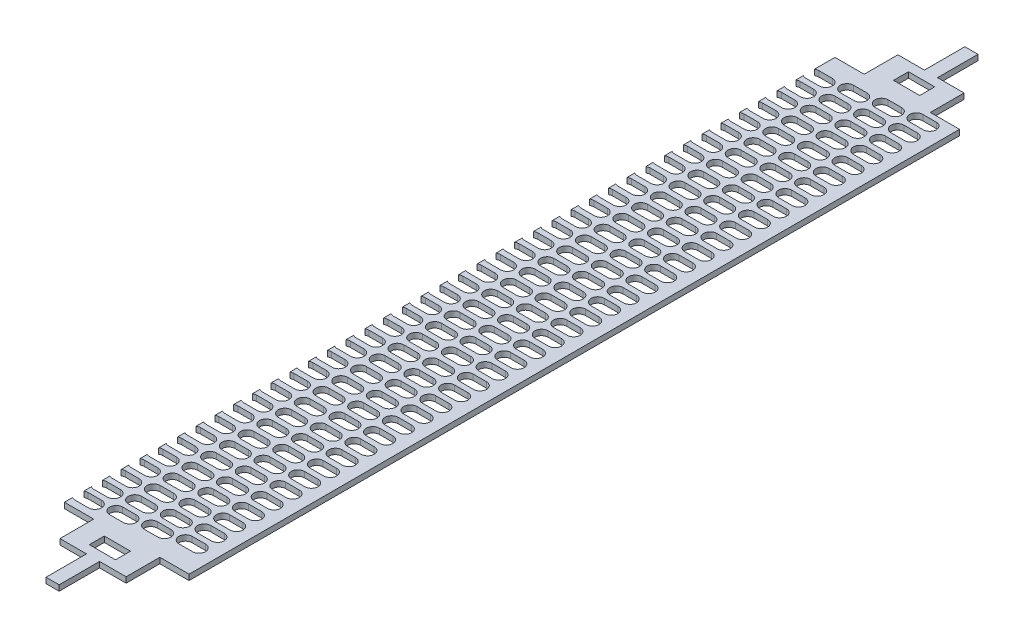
SolidWorks part; units mm, degrees
ref_plane "Alzado" through (0, 0, 0) normal (0, 0, 1) x (1, 0, 0)
ref_plane "Planta" through (0, 0, 0) normal (0, 1, 0) x (1, 0, 0)
ref_plane "Vista lateral" through (0, 0, 0) normal (1, 0, 0) x (0, 0, -1)
sketch "Croquis1" plane through (0, 0, 0) normal (0, 1, 0) x (1, 0, 0)
  line L0 (15.6, 411.2) -> (15.6, 429.2)
  line L1 (0, 0) -> (15.6, 0)
  line L2 (0, 0) -> (0, 4.2983)
  line L3 (0, 411.2) -> (15.6, 411.2)
  line L4 (66.5, 0) -> (66.5, 411.2)
  line L5 (15.6, 429.2) -> (29.75, 429.2)
  line L6 (29.75, 429.2) -> (29.75, 450.8)
  line L7 (29.75, 450.8) -> (36.75, 450.8)
  line L8 (36.75, 450.8) -> (36.75, 429.2)
  line L9 (36.75, 429.2) -> (50.9, 429.2)
  line L10 (50.9, 429.2) -> (50.9, 411.2)
  line L11 (50.9, 411.2) -> (66.5, 411.2)
  line L12 (15.6, 420.2) -> (50.9, 420.2) construction
  line L13 (50.9, 0) -> (50.9, -18)
  line L14 (26.25, 416.2) -> (40.25, 416.2)
  line L15 (26.25, 416.2) -> (26.25, 424.2)
  line L16 (26.25, 424.2) -> (40.25, 424.2)
  line L17 (40.25, 416.2) -> (40.25, 424.2)
  line L18 (26.25, 416.2) -> (40.25, 424.2) construction
  line L19 (26.25, 424.2) -> (40.25, 416.2) construction
  line L20 (50.9, -18) -> (36.75, -18)
  line L21 (36.75, -18) -> (36.75, -39.6)
  line L22 (36.75, -39.6) -> (29.75, -39.6)
  line L23 (29.75, -39.6) -> (29.75, -18)
  line L24 (29.75, -18) -> (15.6, -18)
  line L25 (15.6, -18) -> (15.6, 0)
  line L26 (50.9, 0) -> (66.5, 0)
  line L27 (15.6, -9) -> (50.9, -9) construction
  line L28 (49.8, 408.3) -> (57, 408.3)
  line L29 (26.25, -13) -> (40.25, -13)
  line L30 (26.25, -13) -> (26.25, -5)
  line L31 (26.25, -5) -> (40.25, -5)
  line L32 (40.25, -13) -> (40.25, -5)
  line L33 (26.25, -13) -> (40.25, -5) construction
  line L34 (26.25, -5) -> (40.25, -13) construction
  line L35 (49.8, 401.3) -> (57, 401.3)
  line L36 (33.8, 398.8) -> (41, 398.8)
  line L37 (33.8, 405.8) -> (41, 405.8)
  line L38 (17.8, 396.3) -> (25, 396.3)
  line L39 (17.8, 403.3) -> (25, 403.3)
  line L40 (1.8, 393.8) -> (9, 393.8)
  line L41 (1.8, 400.8) -> (9, 400.8)
  line L42 (0, 400.3017) -> (0, 411.2)
  line L43 (49.8, 398.3) -> (57, 398.3)
  line L44 (49.8, 391.3) -> (57, 391.3)
  line L45 (33.8, 395.8) -> (41, 395.8)
  line L46 (33.8, 388.8) -> (41, 388.8)
  line L47 (17.8, 393.3) -> (25, 393.3)
  line L48 (17.8, 386.3) -> (25, 386.3)
  line L49 (1.8, 390.8) -> (9, 390.8)
  line L50 (1.8, 383.8) -> (9, 383.8)
  line L51 (49.8, 388.3) -> (57, 388.3)
  line L52 (49.8, 381.3) -> (57, 381.3)
  line L53 (33.8, 385.8) -> (41, 385.8)
  line L54 (33.8, 378.8) -> (41, 378.8)
  line L55 (17.8, 383.3) -> (25, 383.3)
  line L56 (17.8, 376.3) -> (25, 376.3)
  line L57 (1.8, 380.8) -> (9, 380.8)
  line L58 (1.8, 373.8) -> (9, 373.8)
  line L59 (49.8, 378.3) -> (57, 378.3)
  line L60 (49.8, 371.3) -> (57, 371.3)
  line L61 (33.8, 375.8) -> (41, 375.8)
  line L62 (33.8, 368.8) -> (41, 368.8)
  line L63 (17.8, 373.3) -> (25, 373.3)
  line L64 (17.8, 366.3) -> (25, 366.3)
  line L65 (1.8, 370.8) -> (9, 370.8)
  line L66 (1.8, 363.8) -> (9, 363.8)
  line L67 (49.8, 368.3) -> (57, 368.3)
  line L68 (49.8, 361.3) -> (57, 361.3)
  line L69 (33.8, 365.8) -> (41, 365.8)
  line L70 (33.8, 358.8) -> (41, 358.8)
  line L71 (17.8, 363.3) -> (25, 363.3)
  line L72 (17.8, 356.3) -> (25, 356.3)
  line L73 (1.8, 360.8) -> (9, 360.8)
  line L74 (1.8, 353.8) -> (9, 353.8)
  line L75 (49.8, 358.3) -> (57, 358.3)
  line L76 (49.8, 351.3) -> (57, 351.3)
  line L77 (33.8, 355.8) -> (41, 355.8)
  line L78 (33.8, 348.8) -> (41, 348.8)
  line L79 (17.8, 353.3) -> (25, 353.3)
  line L80 (17.8, 346.3) -> (25, 346.3)
  line L81 (1.8, 350.8) -> (9, 350.8)
  line L82 (1.8, 343.8) -> (9, 343.8)
  line L83 (49.8, 348.3) -> (57, 348.3)
  line L84 (49.8, 341.3) -> (57, 341.3)
  line L85 (33.8, 345.8) -> (41, 345.8)
  line L86 (33.8, 338.8) -> (41, 338.8)
  line L87 (17.8, 343.3) -> (25, 343.3)
  line L88 (17.8, 336.3) -> (25, 336.3)
  line L89 (1.8, 340.8) -> (9, 340.8)
  line L90 (1.8, 333.8) -> (9, 333.8)
  line L91 (49.8, 338.3) -> (57, 338.3)
  line L92 (49.8, 331.3) -> (57, 331.3)
  line L93 (33.8, 335.8) -> (41, 335.8)
  line L94 (33.8, 328.8) -> (41, 328.8)
  line L95 (17.8, 333.3) -> (25, 333.3)
  line L96 (17.8, 326.3) -> (25, 326.3)
  line L97 (1.8, 330.8) -> (9, 330.8)
  line L98 (1.8, 323.8) -> (9, 323.8)
  line L99 (49.8, 328.3) -> (57, 328.3)
  line L100 (49.8, 321.3) -> (57, 321.3)
  line L101 (33.8, 325.8) -> (41, 325.8)
  line L102 (33.8, 318.8) -> (41, 318.8)
  line L103 (17.8, 323.3) -> (25, 323.3)
  line L104 (17.8, 316.3) -> (25, 316.3)
  line L105 (1.8, 320.8) -> (9, 320.8)
  line L106 (1.8, 313.8) -> (9, 313.8)
  line L107 (49.8, 318.3) -> (57, 318.3)
  line L108 (49.8, 311.3) -> (57, 311.3)
  line L109 (33.8, 315.8) -> (41, 315.8)
  line L110 (33.8, 308.8) -> (41, 308.8)
  line L111 (17.8, 313.3) -> (25, 313.3)
  line L112 (17.8, 306.3) -> (25, 306.3)
  line L113 (1.8, 310.8) -> (9, 310.8)
  line L114 (1.8, 303.8) -> (9, 303.8)
  line L115 (49.8, 308.3) -> (57, 308.3)
  line L116 (49.8, 301.3) -> (57, 301.3)
  line L117 (33.8, 305.8) -> (41, 305.8)
  line L118 (33.8, 298.8) -> (41, 298.8)
  line L119 (17.8, 303.3) -> (25, 303.3)
  line L120 (17.8, 296.3) -> (25, 296.3)
  line L121 (1.8, 300.8) -> (9, 300.8)
  line L122 (1.8, 293.8) -> (9, 293.8)
  line L123 (49.8, 298.3) -> (57, 298.3)
  line L124 (49.8, 291.3) -> (57, 291.3)
  line L125 (33.8, 295.8) -> (41, 295.8)
  line L126 (33.8, 288.8) -> (41, 288.8)
  line L127 (17.8, 293.3) -> (25, 293.3)
  line L128 (17.8, 286.3) -> (25, 286.3)
  line L129 (1.8, 290.8) -> (9, 290.8)
  line L130 (1.8, 283.8) -> (9, 283.8)
  line L131 (49.8, 288.3) -> (57, 288.3)
  line L132 (49.8, 281.3) -> (57, 281.3)
  line L133 (33.8, 285.8) -> (41, 285.8)
  line L134 (33.8, 278.8) -> (41, 278.8)
  line L135 (17.8, 283.3) -> (25, 283.3)
  line L136 (17.8, 276.3) -> (25, 276.3)
  line L137 (1.8, 280.8) -> (9, 280.8)
  line L138 (1.8, 273.8) -> (9, 273.8)
  line L139 (49.8, 278.3) -> (57, 278.3)
  line L140 (49.8, 271.3) -> (57, 271.3)
  line L141 (33.8, 275.8) -> (41, 275.8)
  line L142 (33.8, 268.8) -> (41, 268.8)
  line L143 (17.8, 273.3) -> (25, 273.3)
  line L144 (17.8, 266.3) -> (25, 266.3)
  line L145 (1.8, 270.8) -> (9, 270.8)
  line L146 (1.8, 263.8) -> (9, 263.8)
  line L147 (49.8, 268.3) -> (57, 268.3)
  line L148 (49.8, 261.3) -> (57, 261.3)
  line L149 (33.8, 265.8) -> (41, 265.8)
  line L150 (33.8, 258.8) -> (41, 258.8)
  line L151 (17.8, 263.3) -> (25, 263.3)
  line L152 (17.8, 256.3) -> (25, 256.3)
  line L153 (1.8, 260.8) -> (9, 260.8)
  line L154 (1.8, 253.8) -> (9, 253.8)
  line L155 (49.8, 258.3) -> (57, 258.3)
  line L156 (49.8, 251.3) -> (57, 251.3)
  line L157 (33.8, 255.8) -> (41, 255.8)
  line L158 (33.8, 248.8) -> (41, 248.8)
  line L159 (17.8, 253.3) -> (25, 253.3)
  line L160 (17.8, 246.3) -> (25, 246.3)
  line L161 (1.8, 250.8) -> (9, 250.8)
  line L162 (1.8, 243.8) -> (9, 243.8)
  line L163 (49.8, 248.3) -> (57, 248.3)
  line L164 (49.8, 241.3) -> (57, 241.3)
  line L165 (33.8, 245.8) -> (41, 245.8)
  line L166 (33.8, 238.8) -> (41, 238.8)
  line L167 (17.8, 243.3) -> (25, 243.3)
  line L168 (17.8, 236.3) -> (25, 236.3)
  line L169 (1.8, 240.8) -> (9, 240.8)
  line L170 (1.8, 233.8) -> (9, 233.8)
  line L171 (49.8, 238.3) -> (57, 238.3)
  line L172 (49.8, 231.3) -> (57, 231.3)
  line L173 (33.8, 235.8) -> (41, 235.8)
  line L174 (33.8, 228.8) -> (41, 228.8)
  line L175 (17.8, 233.3) -> (25, 233.3)
  line L176 (17.8, 226.3) -> (25, 226.3)
  line L177 (1.8, 230.8) -> (9, 230.8)
  line L178 (1.8, 223.8) -> (9, 223.8)
  line L179 (49.8, 228.3) -> (57, 228.3)
  line L180 (49.8, 221.3) -> (57, 221.3)
  line L181 (33.8, 225.8) -> (41, 225.8)
  line L182 (33.8, 218.8) -> (41, 218.8)
  line L183 (17.8, 223.3) -> (25, 223.3)
  line L184 (17.8, 216.3) -> (25, 216.3)
  line L185 (1.8, 220.8) -> (9, 220.8)
  line L186 (1.8, 213.8) -> (9, 213.8)
  line L187 (49.8, 218.3) -> (57, 218.3)
  line L188 (49.8, 211.3) -> (57, 211.3)
  line L189 (33.8, 215.8) -> (41, 215.8)
  line L190 (33.8, 208.8) -> (41, 208.8)
  line L191 (17.8, 213.3) -> (25, 213.3)
  line L192 (17.8, 206.3) -> (25, 206.3)
  line L193 (1.8, 210.8) -> (9, 210.8)
  line L194 (1.8, 203.8) -> (9, 203.8)
  line L195 (49.8, 208.3) -> (57, 208.3)
  line L196 (49.8, 201.3) -> (57, 201.3)
  line L197 (33.8, 205.8) -> (41, 205.8)
  line L198 (33.8, 198.8) -> (41, 198.8)
  line L199 (17.8, 203.3) -> (25, 203.3)
  line L200 (17.8, 196.3) -> (25, 196.3)
  line L201 (1.8, 200.8) -> (9, 200.8)
  line L202 (1.8, 193.8) -> (9, 193.8)
  line L203 (49.8, 198.3) -> (57, 198.3)
  line L204 (49.8, 191.3) -> (57, 191.3)
  line L205 (33.8, 195.8) -> (41, 195.8)
  line L206 (33.8, 188.8) -> (41, 188.8)
  line L207 (17.8, 193.3) -> (25, 193.3)
  line L208 (17.8, 186.3) -> (25, 186.3)
  line L209 (1.8, 190.8) -> (9, 190.8)
  line L210 (1.8, 183.8) -> (9, 183.8)
  line L211 (49.8, 188.3) -> (57, 188.3)
  line L212 (49.8, 181.3) -> (57, 181.3)
  line L213 (33.8, 185.8) -> (41, 185.8)
  line L214 (33.8, 178.8) -> (41, 178.8)
  line L215 (17.8, 183.3) -> (25, 183.3)
  line L216 (17.8, 176.3) -> (25, 176.3)
  line L217 (1.8, 180.8) -> (9, 180.8)
  line L218 (1.8, 173.8) -> (9, 173.8)
  line L219 (49.8, 178.3) -> (57, 178.3)
  line L220 (49.8, 171.3) -> (57, 171.3)
  line L221 (33.8, 175.8) -> (41, 175.8)
  line L222 (33.8, 168.8) -> (41, 168.8)
  line L223 (17.8, 173.3) -> (25, 173.3)
  line L224 (17.8, 166.3) -> (25, 166.3)
  line L225 (1.8, 170.8) -> (9, 170.8)
  line L226 (1.8, 163.8) -> (9, 163.8)
  line L227 (49.8, 168.3) -> (57, 168.3)
  line L228 (49.8, 161.3) -> (57, 161.3)
  line L229 (33.8, 165.8) -> (41, 165.8)
  line L230 (33.8, 158.8) -> (41, 158.8)
  line L231 (17.8, 163.3) -> (25, 163.3)
  line L232 (17.8, 156.3) -> (25, 156.3)
  line L233 (1.8, 160.8) -> (9, 160.8)
  line L234 (1.8, 153.8) -> (9, 153.8)
  line L235 (49.8, 158.3) -> (57, 158.3)
  line L236 (49.8, 151.3) -> (57, 151.3)
  line L237 (33.8, 155.8) -> (41, 155.8)
  line L238 (33.8, 148.8) -> (41, 148.8)
  line L239 (17.8, 153.3) -> (25, 153.3)
  line L240 (17.8, 146.3) -> (25, 146.3)
  line L241 (1.8, 150.8) -> (9, 150.8)
  line L242 (1.8, 143.8) -> (9, 143.8)
  line L243 (49.8, 148.3) -> (57, 148.3)
  line L244 (49.8, 141.3) -> (57, 141.3)
  line L245 (33.8, 145.8) -> (41, 145.8)
  line L246 (33.8, 138.8) -> (41, 138.8)
  line L247 (17.8, 143.3) -> (25, 143.3)
  line L248 (17.8, 136.3) -> (25, 136.3)
  line L249 (1.8, 140.8) -> (9, 140.8)
  line L250 (1.8, 133.8) -> (9, 133.8)
  line L251 (49.8, 138.3) -> (57, 138.3)
  line L252 (49.8, 131.3) -> (57, 131.3)
  line L253 (33.8, 135.8) -> (41, 135.8)
  line L254 (33.8, 128.8) -> (41, 128.8)
  line L255 (17.8, 133.3) -> (25, 133.3)
  line L256 (17.8, 126.3) -> (25, 126.3)
  line L257 (1.8, 130.8) -> (9, 130.8)
  line L258 (1.8, 123.8) -> (9, 123.8)
  line L259 (49.8, 128.3) -> (57, 128.3)
  line L260 (49.8, 121.3) -> (57, 121.3)
  line L261 (33.8, 125.8) -> (41, 125.8)
  line L262 (33.8, 118.8) -> (41, 118.8)
  line L263 (17.8, 123.3) -> (25, 123.3)
  line L264 (17.8, 116.3) -> (25, 116.3)
  line L265 (1.8, 120.8) -> (9, 120.8)
  line L266 (1.8, 113.8) -> (9, 113.8)
  line L267 (49.8, 118.3) -> (57, 118.3)
  line L268 (49.8, 111.3) -> (57, 111.3)
  line L269 (33.8, 115.8) -> (41, 115.8)
  line L270 (33.8, 108.8) -> (41, 108.8)
  line L271 (17.8, 113.3) -> (25, 113.3)
  line L272 (17.8, 106.3) -> (25, 106.3)
  line L273 (1.8, 110.8) -> (9, 110.8)
  line L274 (1.8, 103.8) -> (9, 103.8)
  line L275 (49.8, 108.3) -> (57, 108.3)
  line L276 (49.8, 101.3) -> (57, 101.3)
  line L277 (33.8, 105.8) -> (41, 105.8)
  line L278 (33.8, 98.8) -> (41, 98.8)
  line L279 (17.8, 103.3) -> (25, 103.3)
  line L280 (17.8, 96.3) -> (25, 96.3)
  line L281 (1.8, 100.8) -> (9, 100.8)
  line L282 (1.8, 93.8) -> (9, 93.8)
  line L283 (49.8, 98.3) -> (57, 98.3)
  line L284 (49.8, 91.3) -> (57, 91.3)
  line L285 (33.8, 95.8) -> (41, 95.8)
  line L286 (33.8, 88.8) -> (41, 88.8)
  line L287 (17.8, 93.3) -> (25, 93.3)
  line L288 (17.8, 86.3) -> (25, 86.3)
  line L289 (1.8, 90.8) -> (9, 90.8)
  line L290 (1.8, 83.8) -> (9, 83.8)
  line L291 (49.8, 88.3) -> (57, 88.3)
  line L292 (49.8, 81.3) -> (57, 81.3)
  line L293 (33.8, 85.8) -> (41, 85.8)
  line L294 (33.8, 78.8) -> (41, 78.8)
  line L295 (17.8, 83.3) -> (25, 83.3)
  line L296 (17.8, 76.3) -> (25, 76.3)
  line L297 (1.8, 80.8) -> (9, 80.8)
  line L298 (1.8, 73.8) -> (9, 73.8)
  line L299 (49.8, 78.3) -> (57, 78.3)
  line L300 (49.8, 71.3) -> (57, 71.3)
  line L301 (33.8, 75.8) -> (41, 75.8)
  line L302 (33.8, 68.8) -> (41, 68.8)
  line L303 (17.8, 73.3) -> (25, 73.3)
  line L304 (17.8, 66.3) -> (25, 66.3)
  line L305 (1.8, 70.8) -> (9, 70.8)
  line L306 (1.8, 63.8) -> (9, 63.8)
  line L307 (49.8, 68.3) -> (57, 68.3)
  line L308 (49.8, 61.3) -> (57, 61.3)
  line L309 (33.8, 65.8) -> (41, 65.8)
  line L310 (33.8, 58.8) -> (41, 58.8)
  line L311 (17.8, 63.3) -> (25, 63.3)
  line L312 (17.8, 56.3) -> (25, 56.3)
  line L313 (1.8, 60.8) -> (9, 60.8)
  line L314 (1.8, 53.8) -> (9, 53.8)
  line L315 (49.8, 58.3) -> (57, 58.3)
  line L316 (49.8, 51.3) -> (57, 51.3)
  line L317 (33.8, 55.8) -> (41, 55.8)
  line L318 (33.8, 48.8) -> (41, 48.8)
  line L319 (17.8, 53.3) -> (25, 53.3)
  line L320 (17.8, 46.3) -> (25, 46.3)
  line L321 (1.8, 50.8) -> (9, 50.8)
  line L322 (1.8, 43.8) -> (9, 43.8)
  line L323 (49.8, 48.3) -> (57, 48.3)
  line L324 (49.8, 41.3) -> (57, 41.3)
  line L325 (33.8, 45.8) -> (41, 45.8)
  line L326 (33.8, 38.8) -> (41, 38.8)
  line L327 (17.8, 43.3) -> (25, 43.3)
  line L328 (17.8, 36.3) -> (25, 36.3)
  line L329 (1.8, 40.8) -> (9, 40.8)
  line L330 (1.8, 33.8) -> (9, 33.8)
  line L331 (49.8, 38.3) -> (57, 38.3)
  line L332 (49.8, 31.3) -> (57, 31.3)
  line L333 (33.8, 35.8) -> (41, 35.8)
  line L334 (33.8, 28.8) -> (41, 28.8)
  line L335 (17.8, 33.3) -> (25, 33.3)
  line L336 (17.8, 26.3) -> (25, 26.3)
  line L337 (1.8, 30.8) -> (9, 30.8)
  line L338 (1.8, 23.8) -> (9, 23.8)
  line L339 (49.8, 28.3) -> (57, 28.3)
  line L340 (49.8, 21.3) -> (57, 21.3)
  line L341 (33.8, 25.8) -> (41, 25.8)
  line L342 (33.8, 18.8) -> (41, 18.8)
  line L343 (17.8, 23.3) -> (25, 23.3)
  line L344 (17.8, 16.3) -> (25, 16.3)
  line L345 (1.8, 20.8) -> (9, 20.8)
  line L346 (1.8, 13.8) -> (9, 13.8)
  line L347 (49.8, 18.3) -> (57, 18.3)
  line L348 (49.8, 11.3) -> (57, 11.3)
  line L349 (33.8, 15.8) -> (41, 15.8)
  line L350 (33.8, 8.8) -> (41, 8.8)
  line L351 (17.8, 13.3) -> (25, 13.3)
  line L352 (17.8, 6.3) -> (25, 6.3)
  line L353 (1.8, 10.8) -> (9, 10.8)
  line L354 (1.8, 3.8) -> (9, 3.8)
  line L355 (0, 10.3017) -> (0, 14.2983)
  line L356 (0, 20.3017) -> (0, 24.2983)
  line L357 (0, 30.3017) -> (0, 34.2983)
  line L358 (0, 40.3017) -> (0, 44.2983)
  line L359 (0, 50.3017) -> (0, 54.2983)
  line L360 (0, 60.3017) -> (0, 64.2983)
  line L361 (0, 70.3017) -> (0, 74.2983)
  line L362 (0, 80.3017) -> (0, 84.2983)
  line L363 (0, 90.3017) -> (0, 94.2983)
  line L364 (0, 100.3017) -> (0, 104.2983)
  line L365 (0, 110.3017) -> (0, 114.2983)
  line L366 (0, 120.3017) -> (0, 124.2983)
  line L367 (0, 130.3017) -> (0, 134.2983)
  line L368 (0, 140.3017) -> (0, 144.2983)
  line L369 (0, 150.3017) -> (0, 154.2983)
  line L370 (0, 160.3017) -> (0, 164.2983)
  line L371 (0, 170.3017) -> (0, 174.2983)
  line L372 (0, 180.3017) -> (0, 184.2983)
  line L373 (0, 190.3017) -> (0, 194.2983)
  line L374 (0, 200.3017) -> (0, 204.2983)
  line L375 (0, 210.3017) -> (0, 214.2983)
  line L376 (0, 220.3017) -> (0, 224.2983)
  line L377 (0, 230.3017) -> (0, 234.2983)
  line L378 (0, 240.3017) -> (0, 244.2983)
  line L379 (0, 250.3017) -> (0, 254.2983)
  line L380 (0, 260.3017) -> (0, 264.2983)
  line L381 (0, 270.3017) -> (0, 274.2983)
  line L382 (0, 280.3017) -> (0, 284.2983)
  line L383 (0, 290.3017) -> (0, 294.2983)
  line L384 (0, 300.3017) -> (0, 304.2983)
  line L385 (0, 310.3017) -> (0, 314.2983)
  line L386 (0, 320.3017) -> (0, 324.2983)
  line L387 (0, 330.3017) -> (0, 334.2983)
  line L388 (0, 340.3017) -> (0, 344.2983)
  line L389 (0, 350.3017) -> (0, 354.2983)
  line L390 (0, 360.3017) -> (0, 364.2983)
  line L391 (0, 370.3017) -> (0, 374.2983)
  line L392 (0, 380.3017) -> (0, 384.2983)
  line L393 (0, 390.3017) -> (0, 394.2983)
  arc A0 (57, 401.3) -> (57, 408.3) centre (57, 404.8) ccw
  arc A1 (49.8, 408.3) -> (49.8, 401.3) centre (49.8, 404.8) ccw
  arc A2 (41, 398.8) -> (41, 405.8) centre (41, 402.3) ccw
  arc A3 (33.8, 405.8) -> (33.8, 398.8) centre (33.8, 402.3) ccw
  arc A4 (25, 396.3) -> (25, 403.3) centre (25, 399.8) ccw
  arc A5 (17.8, 403.3) -> (17.8, 396.3) centre (17.8, 399.8) ccw
  arc A6 (9, 393.8) -> (9, 400.8) centre (9, 397.3) ccw
  arc A7 (1.8, 400.8) -> (0, 400.3017) centre (1.8, 397.3) ccw
  arc A8 (0, 394.2983) -> (1.8, 393.8) centre (1.8, 397.3) ccw
  arc A9 (57, 391.3) -> (57, 398.3) centre (57, 394.8) ccw
  arc A10 (49.8, 398.3) -> (49.8, 391.3) centre (49.8, 394.8) ccw
  arc A11 (41, 388.8) -> (41, 395.8) centre (41, 392.3) ccw
  arc A12 (33.8, 395.8) -> (33.8, 388.8) centre (33.8, 392.3) ccw
  arc A13 (25, 386.3) -> (25, 393.3) centre (25, 389.8) ccw
  arc A14 (17.8, 393.3) -> (17.8, 386.3) centre (17.8, 389.8) ccw
  arc A15 (9, 383.8) -> (9, 390.8) centre (9, 387.3) ccw
  arc A16 (1.8, 390.8) -> (0, 390.3017) centre (1.8, 387.3) ccw
  arc A17 (0, 384.2983) -> (1.8, 383.8) centre (1.8, 387.3) ccw
  arc A18 (57, 381.3) -> (57, 388.3) centre (57, 384.8) ccw
  arc A19 (49.8, 388.3) -> (49.8, 381.3) centre (49.8, 384.8) ccw
  arc A20 (41, 378.8) -> (41, 385.8) centre (41, 382.3) ccw
  arc A21 (33.8, 385.8) -> (33.8, 378.8) centre (33.8, 382.3) ccw
  arc A22 (25, 376.3) -> (25, 383.3) centre (25, 379.8) ccw
  arc A23 (17.8, 383.3) -> (17.8, 376.3) centre (17.8, 379.8) ccw
  arc A24 (9, 373.8) -> (9, 380.8) centre (9, 377.3) ccw
  arc A25 (1.8, 380.8) -> (0, 380.3017) centre (1.8, 377.3) ccw
  arc A26 (0, 374.2983) -> (1.8, 373.8) centre (1.8, 377.3) ccw
  arc A27 (57, 371.3) -> (57, 378.3) centre (57, 374.8) ccw
  arc A28 (49.8, 378.3) -> (49.8, 371.3) centre (49.8, 374.8) ccw
  arc A29 (41, 368.8) -> (41, 375.8) centre (41, 372.3) ccw
  arc A30 (33.8, 375.8) -> (33.8, 368.8) centre (33.8, 372.3) ccw
  arc A31 (25, 366.3) -> (25, 373.3) centre (25, 369.8) ccw
  arc A32 (17.8, 373.3) -> (17.8, 366.3) centre (17.8, 369.8) ccw
  arc A33 (9, 363.8) -> (9, 370.8) centre (9, 367.3) ccw
  arc A34 (1.8, 370.8) -> (0, 370.3017) centre (1.8, 367.3) ccw
  arc A35 (0, 364.2983) -> (1.8, 363.8) centre (1.8, 367.3) ccw
  arc A36 (57, 361.3) -> (57, 368.3) centre (57, 364.8) ccw
  arc A37 (49.8, 368.3) -> (49.8, 361.3) centre (49.8, 364.8) ccw
  arc A38 (41, 358.8) -> (41, 365.8) centre (41, 362.3) ccw
  arc A39 (33.8, 365.8) -> (33.8, 358.8) centre (33.8, 362.3) ccw
  arc A40 (25, 356.3) -> (25, 363.3) centre (25, 359.8) ccw
  arc A41 (17.8, 363.3) -> (17.8, 356.3) centre (17.8, 359.8) ccw
  arc A42 (9, 353.8) -> (9, 360.8) centre (9, 357.3) ccw
  arc A43 (1.8, 360.8) -> (0, 360.3017) centre (1.8, 357.3) ccw
  arc A44 (0, 354.2983) -> (1.8, 353.8) centre (1.8, 357.3) ccw
  arc A45 (57, 351.3) -> (57, 358.3) centre (57, 354.8) ccw
  arc A46 (49.8, 358.3) -> (49.8, 351.3) centre (49.8, 354.8) ccw
  arc A47 (41, 348.8) -> (41, 355.8) centre (41, 352.3) ccw
  arc A48 (33.8, 355.8) -> (33.8, 348.8) centre (33.8, 352.3) ccw
  arc A49 (25, 346.3) -> (25, 353.3) centre (25, 349.8) ccw
  arc A50 (17.8, 353.3) -> (17.8, 346.3) centre (17.8, 349.8) ccw
  arc A51 (9, 343.8) -> (9, 350.8) centre (9, 347.3) ccw
  arc A52 (1.8, 350.8) -> (0, 350.3017) centre (1.8, 347.3) ccw
  arc A53 (0, 344.2983) -> (1.8, 343.8) centre (1.8, 347.3) ccw
  arc A54 (57, 341.3) -> (57, 348.3) centre (57, 344.8) ccw
  arc A55 (49.8, 348.3) -> (49.8, 341.3) centre (49.8, 344.8) ccw
  arc A56 (41, 338.8) -> (41, 345.8) centre (41, 342.3) ccw
  arc A57 (33.8, 345.8) -> (33.8, 338.8) centre (33.8, 342.3) ccw
  arc A58 (25, 336.3) -> (25, 343.3) centre (25, 339.8) ccw
  arc A59 (17.8, 343.3) -> (17.8, 336.3) centre (17.8, 339.8) ccw
  arc A60 (9, 333.8) -> (9, 340.8) centre (9, 337.3) ccw
  arc A61 (1.8, 340.8) -> (0, 340.3017) centre (1.8, 337.3) ccw
  arc A62 (0, 334.2983) -> (1.8, 333.8) centre (1.8, 337.3) ccw
  arc A63 (57, 331.3) -> (57, 338.3) centre (57, 334.8) ccw
  arc A64 (49.8, 338.3) -> (49.8, 331.3) centre (49.8, 334.8) ccw
  arc A65 (41, 328.8) -> (41, 335.8) centre (41, 332.3) ccw
  arc A66 (33.8, 335.8) -> (33.8, 328.8) centre (33.8, 332.3) ccw
  arc A67 (25, 326.3) -> (25, 333.3) centre (25, 329.8) ccw
  arc A68 (17.8, 333.3) -> (17.8, 326.3) centre (17.8, 329.8) ccw
  arc A69 (9, 323.8) -> (9, 330.8) centre (9, 327.3) ccw
  arc A70 (1.8, 330.8) -> (0, 330.3017) centre (1.8, 327.3) ccw
  arc A71 (0, 324.2983) -> (1.8, 323.8) centre (1.8, 327.3) ccw
  arc A72 (57, 321.3) -> (57, 328.3) centre (57, 324.8) ccw
  arc A73 (49.8, 328.3) -> (49.8, 321.3) centre (49.8, 324.8) ccw
  arc A74 (41, 318.8) -> (41, 325.8) centre (41, 322.3) ccw
  arc A75 (33.8, 325.8) -> (33.8, 318.8) centre (33.8, 322.3) ccw
  arc A76 (25, 316.3) -> (25, 323.3) centre (25, 319.8) ccw
  arc A77 (17.8, 323.3) -> (17.8, 316.3) centre (17.8, 319.8) ccw
  arc A78 (9, 313.8) -> (9, 320.8) centre (9, 317.3) ccw
  arc A79 (1.8, 320.8) -> (0, 320.3017) centre (1.8, 317.3) ccw
  arc A80 (0, 314.2983) -> (1.8, 313.8) centre (1.8, 317.3) ccw
  arc A81 (57, 311.3) -> (57, 318.3) centre (57, 314.8) ccw
  arc A82 (49.8, 318.3) -> (49.8, 311.3) centre (49.8, 314.8) ccw
  arc A83 (41, 308.8) -> (41, 315.8) centre (41, 312.3) ccw
  arc A84 (33.8, 315.8) -> (33.8, 308.8) centre (33.8, 312.3) ccw
  arc A85 (25, 306.3) -> (25, 313.3) centre (25, 309.8) ccw
  arc A86 (17.8, 313.3) -> (17.8, 306.3) centre (17.8, 309.8) ccw
  arc A87 (9, 303.8) -> (9, 310.8) centre (9, 307.3) ccw
  arc A88 (1.8, 310.8) -> (0, 310.3017) centre (1.8, 307.3) ccw
  arc A89 (0, 304.2983) -> (1.8, 303.8) centre (1.8, 307.3) ccw
  arc A90 (57, 301.3) -> (57, 308.3) centre (57, 304.8) ccw
  arc A91 (49.8, 308.3) -> (49.8, 301.3) centre (49.8, 304.8) ccw
  arc A92 (41, 298.8) -> (41, 305.8) centre (41, 302.3) ccw
  arc A93 (33.8, 305.8) -> (33.8, 298.8) centre (33.8, 302.3) ccw
  arc A94 (25, 296.3) -> (25, 303.3) centre (25, 299.8) ccw
  arc A95 (17.8, 303.3) -> (17.8, 296.3) centre (17.8, 299.8) ccw
  arc A96 (9, 293.8) -> (9, 300.8) centre (9, 297.3) ccw
  arc A97 (1.8, 300.8) -> (0, 300.3017) centre (1.8, 297.3) ccw
  arc A98 (0, 294.2983) -> (1.8, 293.8) centre (1.8, 297.3) ccw
  arc A99 (57, 291.3) -> (57, 298.3) centre (57, 294.8) ccw
  arc A100 (49.8, 298.3) -> (49.8, 291.3) centre (49.8, 294.8) ccw
  arc A101 (41, 288.8) -> (41, 295.8) centre (41, 292.3) ccw
  arc A102 (33.8, 295.8) -> (33.8, 288.8) centre (33.8, 292.3) ccw
  arc A103 (25, 286.3) -> (25, 293.3) centre (25, 289.8) ccw
  arc A104 (17.8, 293.3) -> (17.8, 286.3) centre (17.8, 289.8) ccw
  arc A105 (9, 283.8) -> (9, 290.8) centre (9, 287.3) ccw
  arc A106 (1.8, 290.8) -> (0, 290.3017) centre (1.8, 287.3) ccw
  arc A107 (0, 284.2983) -> (1.8, 283.8) centre (1.8, 287.3) ccw
  arc A108 (57, 281.3) -> (57, 288.3) centre (57, 284.8) ccw
  arc A109 (49.8, 288.3) -> (49.8, 281.3) centre (49.8, 284.8) ccw
  arc A110 (41, 278.8) -> (41, 285.8) centre (41, 282.3) ccw
  arc A111 (33.8, 285.8) -> (33.8, 278.8) centre (33.8, 282.3) ccw
  arc A112 (25, 276.3) -> (25, 283.3) centre (25, 279.8) ccw
  arc A113 (17.8, 283.3) -> (17.8, 276.3) centre (17.8, 279.8) ccw
  arc A114 (9, 273.8) -> (9, 280.8) centre (9, 277.3) ccw
  arc A115 (1.8, 280.8) -> (0, 280.3017) centre (1.8, 277.3) ccw
  arc A116 (0, 274.2983) -> (1.8, 273.8) centre (1.8, 277.3) ccw
  arc A117 (57, 271.3) -> (57, 278.3) centre (57, 274.8) ccw
  arc A118 (49.8, 278.3) -> (49.8, 271.3) centre (49.8, 274.8) ccw
  arc A119 (41, 268.8) -> (41, 275.8) centre (41, 272.3) ccw
  arc A120 (33.8, 275.8) -> (33.8, 268.8) centre (33.8, 272.3) ccw
  arc A121 (25, 266.3) -> (25, 273.3) centre (25, 269.8) ccw
  arc A122 (17.8, 273.3) -> (17.8, 266.3) centre (17.8, 269.8) ccw
  arc A123 (9, 263.8) -> (9, 270.8) centre (9, 267.3) ccw
  arc A124 (1.8, 270.8) -> (0, 270.3017) centre (1.8, 267.3) ccw
  arc A125 (0, 264.2983) -> (1.8, 263.8) centre (1.8, 267.3) ccw
  arc A126 (57, 261.3) -> (57, 268.3) centre (57, 264.8) ccw
  arc A127 (49.8, 268.3) -> (49.8, 261.3) centre (49.8, 264.8) ccw
  arc A128 (41, 258.8) -> (41, 265.8) centre (41, 262.3) ccw
  arc A129 (33.8, 265.8) -> (33.8, 258.8) centre (33.8, 262.3) ccw
  arc A130 (25, 256.3) -> (25, 263.3) centre (25, 259.8) ccw
  arc A131 (17.8, 263.3) -> (17.8, 256.3) centre (17.8, 259.8) ccw
  arc A132 (9, 253.8) -> (9, 260.8) centre (9, 257.3) ccw
  arc A133 (1.8, 260.8) -> (0, 260.3017) centre (1.8, 257.3) ccw
  arc A134 (0, 254.2983) -> (1.8, 253.8) centre (1.8, 257.3) ccw
  arc A135 (57, 251.3) -> (57, 258.3) centre (57, 254.8) ccw
  arc A136 (49.8, 258.3) -> (49.8, 251.3) centre (49.8, 254.8) ccw
  arc A137 (41, 248.8) -> (41, 255.8) centre (41, 252.3) ccw
  arc A138 (33.8, 255.8) -> (33.8, 248.8) centre (33.8, 252.3) ccw
  arc A139 (25, 246.3) -> (25, 253.3) centre (25, 249.8) ccw
  arc A140 (17.8, 253.3) -> (17.8, 246.3) centre (17.8, 249.8) ccw
  arc A141 (9, 243.8) -> (9, 250.8) centre (9, 247.3) ccw
  arc A142 (1.8, 250.8) -> (0, 250.3017) centre (1.8, 247.3) ccw
  arc A143 (0, 244.2983) -> (1.8, 243.8) centre (1.8, 247.3) ccw
  arc A144 (57, 241.3) -> (57, 248.3) centre (57, 244.8) ccw
  arc A145 (49.8, 248.3) -> (49.8, 241.3) centre (49.8, 244.8) ccw
  arc A146 (41, 238.8) -> (41, 245.8) centre (41, 242.3) ccw
  arc A147 (33.8, 245.8) -> (33.8, 238.8) centre (33.8, 242.3) ccw
  arc A148 (25, 236.3) -> (25, 243.3) centre (25, 239.8) ccw
  arc A149 (17.8, 243.3) -> (17.8, 236.3) centre (17.8, 239.8) ccw
  arc A150 (9, 233.8) -> (9, 240.8) centre (9, 237.3) ccw
  arc A151 (1.8, 240.8) -> (0, 240.3017) centre (1.8, 237.3) ccw
  arc A152 (0, 234.2983) -> (1.8, 233.8) centre (1.8, 237.3) ccw
  arc A153 (57, 231.3) -> (57, 238.3) centre (57, 234.8) ccw
  arc A154 (49.8, 238.3) -> (49.8, 231.3) centre (49.8, 234.8) ccw
  arc A155 (41, 228.8) -> (41, 235.8) centre (41, 232.3) ccw
  arc A156 (33.8, 235.8) -> (33.8, 228.8) centre (33.8, 232.3) ccw
  arc A157 (25, 226.3) -> (25, 233.3) centre (25, 229.8) ccw
  arc A158 (17.8, 233.3) -> (17.8, 226.3) centre (17.8, 229.8) ccw
  arc A159 (9, 223.8) -> (9, 230.8) centre (9, 227.3) ccw
  arc A160 (1.8, 230.8) -> (0, 230.3017) centre (1.8, 227.3) ccw
  arc A161 (0, 224.2983) -> (1.8, 223.8) centre (1.8, 227.3) ccw
  arc A162 (57, 221.3) -> (57, 228.3) centre (57, 224.8) ccw
  arc A163 (49.8, 228.3) -> (49.8, 221.3) centre (49.8, 224.8) ccw
  arc A164 (41, 218.8) -> (41, 225.8) centre (41, 222.3) ccw
  arc A165 (33.8, 225.8) -> (33.8, 218.8) centre (33.8, 222.3) ccw
  arc A166 (25, 216.3) -> (25, 223.3) centre (25, 219.8) ccw
  arc A167 (17.8, 223.3) -> (17.8, 216.3) centre (17.8, 219.8) ccw
  arc A168 (9, 213.8) -> (9, 220.8) centre (9, 217.3) ccw
  arc A169 (1.8, 220.8) -> (0, 220.3017) centre (1.8, 217.3) ccw
  arc A170 (0, 214.2983) -> (1.8, 213.8) centre (1.8, 217.3) ccw
  arc A171 (57, 211.3) -> (57, 218.3) centre (57, 214.8) ccw
  arc A172 (49.8, 218.3) -> (49.8, 211.3) centre (49.8, 214.8) ccw
  arc A173 (41, 208.8) -> (41, 215.8) centre (41, 212.3) ccw
  arc A174 (33.8, 215.8) -> (33.8, 208.8) centre (33.8, 212.3) ccw
  arc A175 (25, 206.3) -> (25, 213.3) centre (25, 209.8) ccw
  arc A176 (17.8, 213.3) -> (17.8, 206.3) centre (17.8, 209.8) ccw
  arc A177 (9, 203.8) -> (9, 210.8) centre (9, 207.3) ccw
  arc A178 (1.8, 210.8) -> (0, 210.3017) centre (1.8, 207.3) ccw
  arc A179 (0, 204.2983) -> (1.8, 203.8) centre (1.8, 207.3) ccw
  arc A180 (57, 201.3) -> (57, 208.3) centre (57, 204.8) ccw
  arc A181 (49.8, 208.3) -> (49.8, 201.3) centre (49.8, 204.8) ccw
  arc A182 (41, 198.8) -> (41, 205.8) centre (41, 202.3) ccw
  arc A183 (33.8, 205.8) -> (33.8, 198.8) centre (33.8, 202.3) ccw
  arc A184 (25, 196.3) -> (25, 203.3) centre (25, 199.8) ccw
  arc A185 (17.8, 203.3) -> (17.8, 196.3) centre (17.8, 199.8) ccw
  arc A186 (9, 193.8) -> (9, 200.8) centre (9, 197.3) ccw
  arc A187 (1.8, 200.8) -> (0, 200.3017) centre (1.8, 197.3) ccw
  arc A188 (0, 194.2983) -> (1.8, 193.8) centre (1.8, 197.3) ccw
  arc A189 (57, 191.3) -> (57, 198.3) centre (57, 194.8) ccw
  arc A190 (49.8, 198.3) -> (49.8, 191.3) centre (49.8, 194.8) ccw
  arc A191 (41, 188.8) -> (41, 195.8) centre (41, 192.3) ccw
  arc A192 (33.8, 195.8) -> (33.8, 188.8) centre (33.8, 192.3) ccw
  arc A193 (25, 186.3) -> (25, 193.3) centre (25, 189.8) ccw
  arc A194 (17.8, 193.3) -> (17.8, 186.3) centre (17.8, 189.8) ccw
  arc A195 (9, 183.8) -> (9, 190.8) centre (9, 187.3) ccw
  arc A196 (1.8, 190.8) -> (0, 190.3017) centre (1.8, 187.3) ccw
  arc A197 (0, 184.2983) -> (1.8, 183.8) centre (1.8, 187.3) ccw
  arc A198 (57, 181.3) -> (57, 188.3) centre (57, 184.8) ccw
  arc A199 (49.8, 188.3) -> (49.8, 181.3) centre (49.8, 184.8) ccw
  arc A200 (41, 178.8) -> (41, 185.8) centre (41, 182.3) ccw
  arc A201 (33.8, 185.8) -> (33.8, 178.8) centre (33.8, 182.3) ccw
  arc A202 (25, 176.3) -> (25, 183.3) centre (25, 179.8) ccw
  arc A203 (17.8, 183.3) -> (17.8, 176.3) centre (17.8, 179.8) ccw
  arc A204 (9, 173.8) -> (9, 180.8) centre (9, 177.3) ccw
  arc A205 (1.8, 180.8) -> (0, 180.3017) centre (1.8, 177.3) ccw
  arc A206 (0, 174.2983) -> (1.8, 173.8) centre (1.8, 177.3) ccw
  arc A207 (57, 171.3) -> (57, 178.3) centre (57, 174.8) ccw
  arc A208 (49.8, 178.3) -> (49.8, 171.3) centre (49.8, 174.8) ccw
  arc A209 (41, 168.8) -> (41, 175.8) centre (41, 172.3) ccw
  arc A210 (33.8, 175.8) -> (33.8, 168.8) centre (33.8, 172.3) ccw
  arc A211 (25, 166.3) -> (25, 173.3) centre (25, 169.8) ccw
  arc A212 (17.8, 173.3) -> (17.8, 166.3) centre (17.8, 169.8) ccw
  arc A213 (9, 163.8) -> (9, 170.8) centre (9, 167.3) ccw
  arc A214 (1.8, 170.8) -> (0, 170.3017) centre (1.8, 167.3) ccw
  arc A215 (0, 164.2983) -> (1.8, 163.8) centre (1.8, 167.3) ccw
  arc A216 (57, 161.3) -> (57, 168.3) centre (57, 164.8) ccw
  arc A217 (49.8, 168.3) -> (49.8, 161.3) centre (49.8, 164.8) ccw
  arc A218 (41, 158.8) -> (41, 165.8) centre (41, 162.3) ccw
  arc A219 (33.8, 165.8) -> (33.8, 158.8) centre (33.8, 162.3) ccw
  arc A220 (25, 156.3) -> (25, 163.3) centre (25, 159.8) ccw
  arc A221 (17.8, 163.3) -> (17.8, 156.3) centre (17.8, 159.8) ccw
  arc A222 (9, 153.8) -> (9, 160.8) centre (9, 157.3) ccw
  arc A223 (1.8, 160.8) -> (0, 160.3017) centre (1.8, 157.3) ccw
  arc A224 (0, 154.2983) -> (1.8, 153.8) centre (1.8, 157.3) ccw
  arc A225 (57, 151.3) -> (57, 158.3) centre (57, 154.8) ccw
  arc A226 (49.8, 158.3) -> (49.8, 151.3) centre (49.8, 154.8) ccw
  arc A227 (41, 148.8) -> (41, 155.8) centre (41, 152.3) ccw
  arc A228 (33.8, 155.8) -> (33.8, 148.8) centre (33.8, 152.3) ccw
  arc A229 (25, 146.3) -> (25, 153.3) centre (25, 149.8) ccw
  arc A230 (17.8, 153.3) -> (17.8, 146.3) centre (17.8, 149.8) ccw
  arc A231 (9, 143.8) -> (9, 150.8) centre (9, 147.3) ccw
  arc A232 (1.8, 150.8) -> (0, 150.3017) centre (1.8, 147.3) ccw
  arc A233 (0, 144.2983) -> (1.8, 143.8) centre (1.8, 147.3) ccw
  arc A234 (57, 141.3) -> (57, 148.3) centre (57, 144.8) ccw
  arc A235 (49.8, 148.3) -> (49.8, 141.3) centre (49.8, 144.8) ccw
  arc A236 (41, 138.8) -> (41, 145.8) centre (41, 142.3) ccw
  arc A237 (33.8, 145.8) -> (33.8, 138.8) centre (33.8, 142.3) ccw
  arc A238 (25, 136.3) -> (25, 143.3) centre (25, 139.8) ccw
  arc A239 (17.8, 143.3) -> (17.8, 136.3) centre (17.8, 139.8) ccw
  arc A240 (9, 133.8) -> (9, 140.8) centre (9, 137.3) ccw
  arc A241 (1.8, 140.8) -> (0, 140.3017) centre (1.8, 137.3) ccw
  arc A242 (0, 134.2983) -> (1.8, 133.8) centre (1.8, 137.3) ccw
  arc A243 (57, 131.3) -> (57, 138.3) centre (57, 134.8) ccw
  arc A244 (49.8, 138.3) -> (49.8, 131.3) centre (49.8, 134.8) ccw
  arc A245 (41, 128.8) -> (41, 135.8) centre (41, 132.3) ccw
  arc A246 (33.8, 135.8) -> (33.8, 128.8) centre (33.8, 132.3) ccw
  arc A247 (25, 126.3) -> (25, 133.3) centre (25, 129.8) ccw
  arc A248 (17.8, 133.3) -> (17.8, 126.3) centre (17.8, 129.8) ccw
  arc A249 (9, 123.8) -> (9, 130.8) centre (9, 127.3) ccw
  arc A250 (1.8, 130.8) -> (0, 130.3017) centre (1.8, 127.3) ccw
  arc A251 (0, 124.2983) -> (1.8, 123.8) centre (1.8, 127.3) ccw
  arc A252 (57, 121.3) -> (57, 128.3) centre (57, 124.8) ccw
  arc A253 (49.8, 128.3) -> (49.8, 121.3) centre (49.8, 124.8) ccw
  arc A254 (41, 118.8) -> (41, 125.8) centre (41, 122.3) ccw
  arc A255 (33.8, 125.8) -> (33.8, 118.8) centre (33.8, 122.3) ccw
  arc A256 (25, 116.3) -> (25, 123.3) centre (25, 119.8) ccw
  arc A257 (17.8, 123.3) -> (17.8, 116.3) centre (17.8, 119.8) ccw
  arc A258 (9, 113.8) -> (9, 120.8) centre (9, 117.3) ccw
  arc A259 (1.8, 120.8) -> (0, 120.3017) centre (1.8, 117.3) ccw
  arc A260 (0, 114.2983) -> (1.8, 113.8) centre (1.8, 117.3) ccw
  arc A261 (57, 111.3) -> (57, 118.3) centre (57, 114.8) ccw
  arc A262 (49.8, 118.3) -> (49.8, 111.3) centre (49.8, 114.8) ccw
  arc A263 (41, 108.8) -> (41, 115.8) centre (41, 112.3) ccw
  arc A264 (33.8, 115.8) -> (33.8, 108.8) centre (33.8, 112.3) ccw
  arc A265 (25, 106.3) -> (25, 113.3) centre (25, 109.8) ccw
  arc A266 (17.8, 113.3) -> (17.8, 106.3) centre (17.8, 109.8) ccw
  arc A267 (9, 103.8) -> (9, 110.8) centre (9, 107.3) ccw
  arc A268 (1.8, 110.8) -> (0, 110.3017) centre (1.8, 107.3) ccw
  arc A269 (0, 104.2983) -> (1.8, 103.8) centre (1.8, 107.3) ccw
  arc A270 (57, 101.3) -> (57, 108.3) centre (57, 104.8) ccw
  arc A271 (49.8, 108.3) -> (49.8, 101.3) centre (49.8, 104.8) ccw
  arc A272 (41, 98.8) -> (41, 105.8) centre (41, 102.3) ccw
  arc A273 (33.8, 105.8) -> (33.8, 98.8) centre (33.8, 102.3) ccw
  arc A274 (25, 96.3) -> (25, 103.3) centre (25, 99.8) ccw
  arc A275 (17.8, 103.3) -> (17.8, 96.3) centre (17.8, 99.8) ccw
  arc A276 (9, 93.8) -> (9, 100.8) centre (9, 97.3) ccw
  arc A277 (1.8, 100.8) -> (0, 100.3017) centre (1.8, 97.3) ccw
  arc A278 (0, 94.2983) -> (1.8, 93.8) centre (1.8, 97.3) ccw
  arc A279 (57, 91.3) -> (57, 98.3) centre (57, 94.8) ccw
  arc A280 (49.8, 98.3) -> (49.8, 91.3) centre (49.8, 94.8) ccw
  arc A281 (41, 88.8) -> (41, 95.8) centre (41, 92.3) ccw
  arc A282 (33.8, 95.8) -> (33.8, 88.8) centre (33.8, 92.3) ccw
  arc A283 (25, 86.3) -> (25, 93.3) centre (25, 89.8) ccw
  arc A284 (17.8, 93.3) -> (17.8, 86.3) centre (17.8, 89.8) ccw
  arc A285 (9, 83.8) -> (9, 90.8) centre (9, 87.3) ccw
  arc A286 (1.8, 90.8) -> (0, 90.3017) centre (1.8, 87.3) ccw
  arc A287 (0, 84.2983) -> (1.8, 83.8) centre (1.8, 87.3) ccw
  arc A288 (57, 81.3) -> (57, 88.3) centre (57, 84.8) ccw
  arc A289 (49.8, 88.3) -> (49.8, 81.3) centre (49.8, 84.8) ccw
  arc A290 (41, 78.8) -> (41, 85.8) centre (41, 82.3) ccw
  arc A291 (33.8, 85.8) -> (33.8, 78.8) centre (33.8, 82.3) ccw
  arc A292 (25, 76.3) -> (25, 83.3) centre (25, 79.8) ccw
  arc A293 (17.8, 83.3) -> (17.8, 76.3) centre (17.8, 79.8) ccw
  arc A294 (9, 73.8) -> (9, 80.8) centre (9, 77.3) ccw
  arc A295 (1.8, 80.8) -> (0, 80.3017) centre (1.8, 77.3) ccw
  arc A296 (0, 74.2983) -> (1.8, 73.8) centre (1.8, 77.3) ccw
  arc A297 (57, 71.3) -> (57, 78.3) centre (57, 74.8) ccw
  arc A298 (49.8, 78.3) -> (49.8, 71.3) centre (49.8, 74.8) ccw
  arc A299 (41, 68.8) -> (41, 75.8) centre (41, 72.3) ccw
  arc A300 (33.8, 75.8) -> (33.8, 68.8) centre (33.8, 72.3) ccw
  arc A301 (25, 66.3) -> (25, 73.3) centre (25, 69.8) ccw
  arc A302 (17.8, 73.3) -> (17.8, 66.3) centre (17.8, 69.8) ccw
  arc A303 (9, 63.8) -> (9, 70.8) centre (9, 67.3) ccw
  arc A304 (1.8, 70.8) -> (0, 70.3017) centre (1.8, 67.3) ccw
  arc A305 (0, 64.2983) -> (1.8, 63.8) centre (1.8, 67.3) ccw
  arc A306 (57, 61.3) -> (57, 68.3) centre (57, 64.8) ccw
  arc A307 (49.8, 68.3) -> (49.8, 61.3) centre (49.8, 64.8) ccw
  arc A308 (41, 58.8) -> (41, 65.8) centre (41, 62.3) ccw
  arc A309 (33.8, 65.8) -> (33.8, 58.8) centre (33.8, 62.3) ccw
  arc A310 (25, 56.3) -> (25, 63.3) centre (25, 59.8) ccw
  arc A311 (17.8, 63.3) -> (17.8, 56.3) centre (17.8, 59.8) ccw
  arc A312 (9, 53.8) -> (9, 60.8) centre (9, 57.3) ccw
  arc A313 (1.8, 60.8) -> (0, 60.3017) centre (1.8, 57.3) ccw
  arc A314 (0, 54.2983) -> (1.8, 53.8) centre (1.8, 57.3) ccw
  arc A315 (57, 51.3) -> (57, 58.3) centre (57, 54.8) ccw
  arc A316 (49.8, 58.3) -> (49.8, 51.3) centre (49.8, 54.8) ccw
  arc A317 (41, 48.8) -> (41, 55.8) centre (41, 52.3) ccw
  arc A318 (33.8, 55.8) -> (33.8, 48.8) centre (33.8, 52.3) ccw
  arc A319 (25, 46.3) -> (25, 53.3) centre (25, 49.8) ccw
  arc A320 (17.8, 53.3) -> (17.8, 46.3) centre (17.8, 49.8) ccw
  arc A321 (9, 43.8) -> (9, 50.8) centre (9, 47.3) ccw
  arc A322 (1.8, 50.8) -> (0, 50.3017) centre (1.8, 47.3) ccw
  arc A323 (0, 44.2983) -> (1.8, 43.8) centre (1.8, 47.3) ccw
  arc A324 (57, 41.3) -> (57, 48.3) centre (57, 44.8) ccw
  arc A325 (49.8, 48.3) -> (49.8, 41.3) centre (49.8, 44.8) ccw
  arc A326 (41, 38.8) -> (41, 45.8) centre (41, 42.3) ccw
  arc A327 (33.8, 45.8) -> (33.8, 38.8) centre (33.8, 42.3) ccw
  arc A328 (25, 36.3) -> (25, 43.3) centre (25, 39.8) ccw
  arc A329 (17.8, 43.3) -> (17.8, 36.3) centre (17.8, 39.8) ccw
  arc A330 (9, 33.8) -> (9, 40.8) centre (9, 37.3) ccw
  arc A331 (1.8, 40.8) -> (0, 40.3017) centre (1.8, 37.3) ccw
  arc A332 (0, 34.2983) -> (1.8, 33.8) centre (1.8, 37.3) ccw
  arc A333 (57, 31.3) -> (57, 38.3) centre (57, 34.8) ccw
  arc A334 (49.8, 38.3) -> (49.8, 31.3) centre (49.8, 34.8) ccw
  arc A335 (41, 28.8) -> (41, 35.8) centre (41, 32.3) ccw
  arc A336 (33.8, 35.8) -> (33.8, 28.8) centre (33.8, 32.3) ccw
  arc A337 (25, 26.3) -> (25, 33.3) centre (25, 29.8) ccw
  arc A338 (17.8, 33.3) -> (17.8, 26.3) centre (17.8, 29.8) ccw
  arc A339 (9, 23.8) -> (9, 30.8) centre (9, 27.3) ccw
  arc A340 (1.8, 30.8) -> (0, 30.3017) centre (1.8, 27.3) ccw
  arc A341 (0, 24.2983) -> (1.8, 23.8) centre (1.8, 27.3) ccw
  arc A342 (57, 21.3) -> (57, 28.3) centre (57, 24.8) ccw
  arc A343 (49.8, 28.3) -> (49.8, 21.3) centre (49.8, 24.8) ccw
  arc A344 (41, 18.8) -> (41, 25.8) centre (41, 22.3) ccw
  arc A345 (33.8, 25.8) -> (33.8, 18.8) centre (33.8, 22.3) ccw
  arc A346 (25, 16.3) -> (25, 23.3) centre (25, 19.8) ccw
  arc A347 (17.8, 23.3) -> (17.8, 16.3) centre (17.8, 19.8) ccw
  arc A348 (9, 13.8) -> (9, 20.8) centre (9, 17.3) ccw
  arc A349 (1.8, 20.8) -> (0, 20.3017) centre (1.8, 17.3) ccw
  arc A350 (0, 14.2983) -> (1.8, 13.8) centre (1.8, 17.3) ccw
  arc A351 (57, 11.3) -> (57, 18.3) centre (57, 14.8) ccw
  arc A352 (49.8, 18.3) -> (49.8, 11.3) centre (49.8, 14.8) ccw
  arc A353 (41, 8.8) -> (41, 15.8) centre (41, 12.3) ccw
  arc A354 (33.8, 15.8) -> (33.8, 8.8) centre (33.8, 12.3) ccw
  arc A355 (25, 6.3) -> (25, 13.3) centre (25, 9.8) ccw
  arc A356 (17.8, 13.3) -> (17.8, 6.3) centre (17.8, 9.8) ccw
  arc A357 (9, 3.8) -> (9, 10.8) centre (9, 7.3) ccw
  arc A358 (1.8, 10.8) -> (0, 10.3017) centre (1.8, 7.3) ccw
  arc A359 (0, 4.2983) -> (1.8, 3.8) centre (1.8, 7.3) ccw
  point P15 (33.25, 420.2)
  point P30 (33.25, -9)
  dimension "D18" = 7
  dimension "D20" = 6.4
  dimension "D21" = 40
  dimension "D22" = 7.2
  dimension "D23" = 11.3
  dimension "D1" = 411.2
  dimension "D2" = 66.5
  dimension "D3" = 15.6
  dimension "D4" = 18
  dimension "D5" = 14.15
  dimension "D6" = 21.6
  dimension "D7" = 7
  dimension "D8" = 14.15
  dimension "D9" = 8
  dimension "D10" = 14
  dimension "D11" = 18
  dimension "D12" = 21.6
  dimension "D13" = 14.15
  dimension "D14" = 7
  dimension "D15" = 14.15
  dimension "D16" = 8
  dimension "D17" = 14
  dimension "D19" = 9.5
extrude "Saliente-Extruir1" add sketch "Croquis1" along normal blind 3
